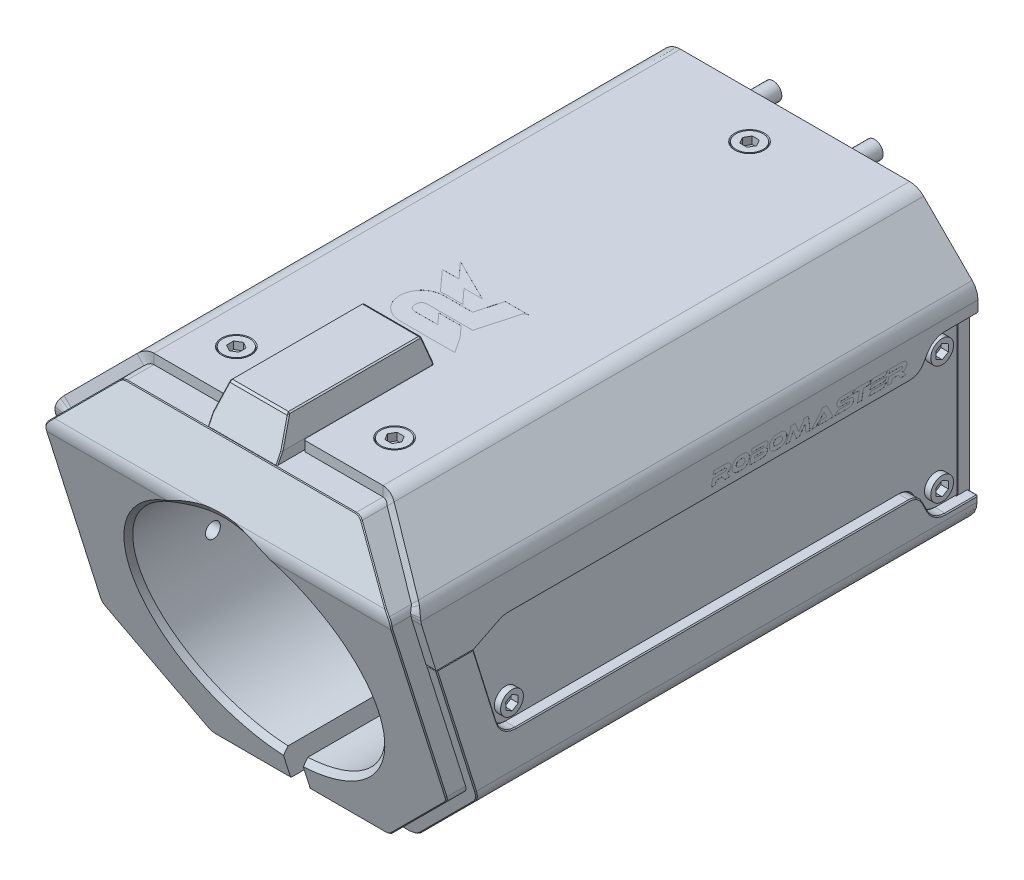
SolidWorks part; units mm, degrees
ref_plane "前视基准面" through (0, 0, 0) normal (0, 0, 1) x (1, 0, 0)
ref_plane "上视基准面" through (0, 0, 0) normal (0, 1, 0) x (1, 0, 0)
ref_plane "右视基准面" through (0, 0, 0) normal (1, 0, 0) x (0, 0, -1)
imported_body "输入34"
imported_body "输入35"
imported_body "输入36"
imported_body "输入37"
imported_body "输入38"
imported_body "输入39"
imported_body "输入40"
imported_body "输入41"
imported_body "输入42"
imported_body "输入43"
imported_body "输入44"
imported_body "输入45"
imported_body "输入46"
imported_body "输入47"
imported_body "输入48"
imported_body "输入49"
imported_body "输入50"
imported_body "输入51"
imported_body "输入52"
imported_body "输入53"
imported_body "输入54"
imported_body "输入55"
imported_body "输入56"
imported_body "输入57"
imported_body "输入58"
imported_body "输入59"
imported_body "输入60"
imported_body "输入61"
imported_body "输入62"
imported_body "输入63"
imported_body "输入64"
imported_body "输入65"
imported_body "输入66"
imported_body "输入67"
sketch "草图1" plane through (13.4739, 0, 0) normal (1, 0, 0) x (0, 0, -1)
  line L0 (-58.9328, 118.4496) -> (-58.9328, 92.181)
  line L1 (-58.9328, 92.181) -> (34.9176, 92.181)
  line L2 (34.9176, 92.181) -> (34.9176, 121.7928)
  line L3 (34.9176, 121.7928) -> (-58.9328, 118.4496)
extrude "切除-拉伸1" cut sketch "草图1" against normal blind 80
